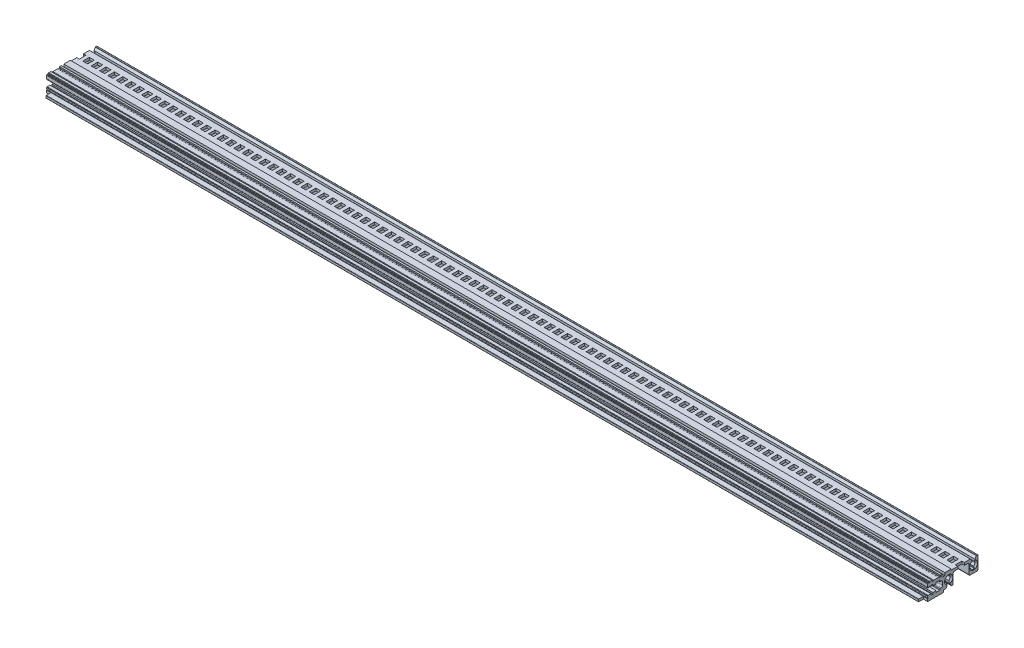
SolidWorks part; units mm, degrees
other "1"
ref_plane "前视基准面" through (0, 0, 0) normal (0, 0, 1) x (1, 0, 0)
ref_plane "上视基准面" through (0, 0, 0) normal (0, 1, 0) x (1, 0, 0)
ref_plane "右视基准面" through (0, 0, 0) normal (1, 0, 0) x (0, 0, -1)
imported_body "输入1"
sketch "草图1" plane through (215.9, 0, 0) normal (1, 0, 0) x (0, 0, -1)
  line L1 (-26.4209, 2.8831) -> (15.5559, 2.8831)
  line L2 (-26.4209, 2.8831) -> (-26.4209, -10.7534)
  line L3 (-26.4209, -10.7534) -> (15.5559, -10.7534)
  line L4 (15.5559, 2.8831) -> (15.5559, -10.7534)
extrude "切除-拉伸1" cut sketch "草图1" against normal up to surface (21.82 mm away)
sketch "草图2" plane through (194.08, 0, 0) normal (1, 0, 0) x (0, 0, -1)
  line L74 (5.5936, 0) -> (-5.95, 0)
  line L75 (-5.95, 0) -> (-5.95, 0.6)
  line L76 (-5.95, 0.6) -> (-9.85, 0.6)
  line L77 (-9.85, 0.6) -> (-9.85, -0.8)
  line L78 (-10.05, -1) -> (-11.25, -1)
  line L79 (-11.45, -0.8) -> (-11.45, 0.6)
  line L80 (-11.45, 0.6) -> (-12.5, 0.6)
  line L81 (-12.5, 0.6) -> (-12.5, -0.1)
  line L82 (-12.7, -0.3) -> (-13.3, -0.3)
  line L83 (-13.6873, 0) -> (-16.5127, 0)
  line L84 (-16.9, -0.3) -> (-17.5, -0.3)
  line L85 (-17.7, -0.1) -> (-17.7, 0.6)
  line L86 (-17.7, 0.6) -> (-18.95, 0.6)
  line L87 (-19.15, 0.4) -> (-19.15, 0.1)
  line L88 (-19.35, -0.1) -> (-19.45, -0.1)
  line L89 (-19.65, 0.1) -> (-19.65, 0.2)
  line L90 (-19.85, 0.4) -> (-19.95, 0.4)
  line L91 (-20.15, 0.2) -> (-20.15, 0.0328)
  line L92 (-20.2086, -0.1086) -> (-20.25, -0.15)
  line L93 (-20.25, -0.15) -> (-20.25, -1.95)
  line L94 (-20.25, -1.95) -> (-20.2086, -1.9914)
  line L95 (-20.15, -2.1328) -> (-20.15, -2.3)
  line L96 (-19.95, -2.5) -> (-19.85, -2.5)
  line L97 (-19.65, -2.3) -> (-19.65, -2.2)
  line L98 (-19.45, -2) -> (-19.2328, -2)
  line L99 (-19.0914, -2.0586) -> (-18.5089, -2.6411)
  line L100 (-18.3675, -2.6997) -> (-18.25, -2.6997)
  line L101 (-18.25, -2.6997) -> (-18.25, -1.85)
  line L102 (-18.25, -1.85) -> (-17.05, -1.85)
  line L103 (-17.05, -1.85) -> (-17.05, -2.7)
  line L104 (-17.05, -2.7) -> (-15.05, -2.7)
  line L105 (-15.05, -2.7) -> (-15.05, -1.85)
  line L106 (-15.05, -1.85) -> (-12.85, -1.85)
  line L107 (-12.85, -1.85) -> (-12.85, -2.7)
  line L108 (-12.85, -2.7) -> (-12.05, -2.7)
  line L109 (-11.25, -3.5) -> (-11.25, -5.45)
  line L110 (-12.05, -6.25) -> (-12.85, -6.25)
  line L111 (-12.85, -6.25) -> (-12.85, -7.1)
  line L112 (-12.85, -7.1) -> (-15.05, -7.1)
  line L113 (-15.05, -7.1) -> (-15.05, -6.25)
  line L114 (-15.05, -6.25) -> (-17.05, -6.25)
  line L115 (-17.05, -6.25) -> (-17.05, -7.1)
  line L116 (-17.05, -7.1) -> (-18.25, -7.1)
  line L117 (-18.25, -7.1) -> (-18.25, -6.2497)
  line L118 (-18.25, -6.2497) -> (-19.95, -6.2497)
  line L119 (-20.1974, -6.497) -> (-20.25, -6.5497)
  line L120 (-20.25, -6.5497) -> (-20.25, -7.2765)
  line L121 (-20.15, -7.4497) -> (-20.15, -7.8)
  line L122 (-20.25, -7.9) -> (-23.05, -7.9)
  line L123 (-23.25, -8.1) -> (-23.25, -9.2)
  line L124 (-23.05, -9.4) -> (-10.9, -9.4)
  line L125 (-10.7, -9.2) -> (-10.7, -8.1)
  line L126 (-10.7, -8.1) -> (-9.2333, -8.1)
  line L127 (-9.0601, -8) -> (-8.425, -6.9)
  line L128 (-8.425, -6.9) -> (-8.425, -5.0408)
  line L129 (-8.425, -3.3592) -> (-8.425, -2.557)
  line L130 (-8.075, -1.7) -> (-6.925, -1.7)
  line L131 (-6.575, -2.5571) -> (-6.575, -3.3592)
  line L132 (-6.575, -5.0408) -> (-6.575, -6.9001)
  line L133 (-6.575, -6.9001) -> (-5.7669, -8.3)
  line L134 (-5.5937, -8.4) -> (-4.95, -8.4)
  line L135 (-4.75, -8.2) -> (-4.75, -2.3)
  line L136 (-3.95, -1.5) -> (3.95, -1.5)
  line L137 (4.75, -2.3) -> (4.75, -7.6)
  line L138 (5.55, -8.4) -> (9.45, -8.4)
  line L139 (10.25, -7.6) -> (10.25, -0.2)
  line L140 (10.05, 0) -> (9.4065, 0)
  line L141 (9.2333, -0.1) -> (8.425, -1.5)
  line L142 (8.425, -1.5) -> (8.425, -3.3592)
  line L143 (8.425, -5.0408) -> (8.425, -6.2)
  line L144 (8.225, -6.4) -> (6.775, -6.4)
  line L145 (6.575, -6.2) -> (6.575, -5.0408)
  line L146 (6.575, -3.3592) -> (6.575, -1.5)
  line L147 (6.575, -1.5) -> (5.7668, -0.1)
  line L148 (5.5936, 0) -> (-5.95, 0)
  line L149 (-5.95, 0) -> (-5.95, 0.6)
  line L150 (-5.95, 0.6) -> (-9.85, 0.6)
  line L151 (-9.85, 0.6) -> (-9.85, -0.8)
  line L152 (-10.05, -1) -> (-11.25, -1)
  line L153 (-11.45, -0.8) -> (-11.45, 0.6)
  line L154 (-11.45, 0.6) -> (-12.5, 0.6)
  line L155 (-12.5, 0.6) -> (-12.5, -0.1)
  line L156 (-12.7, -0.3) -> (-13.3, -0.3)
  line L157 (-13.6873, 0) -> (-16.5127, 0)
  line L158 (-16.9, -0.3) -> (-17.5, -0.3)
  line L159 (-17.7, -0.1) -> (-17.7, 0.6)
  line L160 (-17.7, 0.6) -> (-18.95, 0.6)
  line L161 (-19.15, 0.4) -> (-19.15, 0.1)
  line L162 (-19.35, -0.1) -> (-19.45, -0.1)
  line L163 (-19.65, 0.1) -> (-19.65, 0.2)
  line L164 (-19.85, 0.4) -> (-19.95, 0.4)
  line L165 (-20.15, 0.2) -> (-20.15, 0.0328)
  line L166 (-20.2086, -0.1086) -> (-20.25, -0.15)
  line L167 (-20.25, -0.15) -> (-20.25, -1.95)
  line L168 (-20.25, -1.95) -> (-20.2086, -1.9914)
  line L169 (-20.15, -2.1328) -> (-20.15, -2.3)
  line L170 (-19.95, -2.5) -> (-19.85, -2.5)
  line L171 (-19.65, -2.3) -> (-19.65, -2.2)
  line L172 (-19.45, -2) -> (-19.2328, -2)
  line L173 (-19.0914, -2.0586) -> (-18.5089, -2.6411)
  line L174 (-18.3675, -2.6997) -> (-18.25, -2.6997)
  line L175 (-18.25, -2.6997) -> (-18.25, -1.85)
  line L176 (-18.25, -1.85) -> (-17.05, -1.85)
  line L177 (-17.05, -1.85) -> (-17.05, -2.7)
  line L178 (-17.05, -2.7) -> (-15.05, -2.7)
  line L179 (-15.05, -2.7) -> (-15.05, -1.85)
  line L180 (-15.05, -1.85) -> (-12.85, -1.85)
  line L181 (-12.85, -1.85) -> (-12.85, -2.7)
  line L182 (-12.85, -2.7) -> (-12.05, -2.7)
  line L183 (-11.25, -3.5) -> (-11.25, -5.45)
  line L184 (-12.05, -6.25) -> (-12.85, -6.25)
  line L185 (-12.85, -6.25) -> (-12.85, -7.1)
  line L186 (-12.85, -7.1) -> (-15.05, -7.1)
  line L187 (-15.05, -7.1) -> (-15.05, -6.25)
  line L188 (-15.05, -6.25) -> (-17.05, -6.25)
  line L189 (-17.05, -6.25) -> (-17.05, -7.1)
  line L190 (-17.05, -7.1) -> (-18.25, -7.1)
  line L191 (-18.25, -7.1) -> (-18.25, -6.2497)
  line L192 (-18.25, -6.2497) -> (-19.95, -6.2497)
  line L193 (-20.1974, -6.497) -> (-20.25, -6.5497)
  line L194 (-20.25, -6.5497) -> (-20.25, -7.2765)
  line L195 (-20.15, -7.4497) -> (-20.15, -7.8)
  line L196 (-20.25, -7.9) -> (-23.05, -7.9)
  line L197 (-23.25, -8.1) -> (-23.25, -9.2)
  line L198 (-23.05, -9.4) -> (-10.9, -9.4)
  line L199 (-10.7, -9.2) -> (-10.7, -8.1)
  line L200 (-10.7, -8.1) -> (-9.2333, -8.1)
  line L201 (-9.0601, -8) -> (-8.425, -6.9)
  line L202 (-8.425, -6.9) -> (-8.425, -5.0408)
  line L203 (-8.425, -3.3592) -> (-8.425, -2.557)
  line L204 (-8.075, -1.7) -> (-6.925, -1.7)
  line L205 (-6.575, -2.5571) -> (-6.575, -3.3592)
  line L206 (-6.575, -5.0408) -> (-6.575, -6.9001)
  line L207 (-6.575, -6.9001) -> (-5.7669, -8.3)
  line L208 (-5.5937, -8.4) -> (-4.95, -8.4)
  line L209 (-4.75, -8.2) -> (-4.75, -2.3)
  line L210 (-3.95, -1.5) -> (3.95, -1.5)
  line L211 (4.75, -2.3) -> (4.75, -7.6)
  line L212 (5.55, -8.4) -> (9.45, -8.4)
  line L213 (10.25, -7.6) -> (10.25, -0.2)
  line L214 (10.05, 0) -> (9.4065, 0)
  line L215 (9.2333, -0.1) -> (8.425, -1.5)
  line L216 (8.425, -1.5) -> (8.425, -3.3592)
  line L217 (8.425, -5.0408) -> (8.425, -6.2)
  line L218 (8.225, -6.4) -> (6.775, -6.4)
  line L219 (6.575, -6.2) -> (6.575, -5.0408)
  line L220 (6.575, -3.3592) -> (6.575, -1.5)
  line L221 (6.575, -1.5) -> (5.7668, -0.1)
  arc A47 (-10.05, -1) -> (-9.85, -0.8) centre (-10.05, -0.8) ccw
  arc A48 (-11.45, -0.8) -> (-11.25, -1) centre (-11.25, -0.8) ccw
  arc A49 (-12.7, -0.3) -> (-12.5, -0.1) centre (-12.7, -0.1) ccw
  arc A50 (-13.4936, -0.15) -> (-13.3, -0.3) centre (-13.3, -0.1) ccw
  arc A51 (-13.4936, -0.15) -> (-13.6873, 0) centre (-13.6873, -0.2) ccw
  arc A52 (-16.5127, 0) -> (-16.7063, -0.15) centre (-16.5127, -0.2) ccw
  arc A53 (-16.9, -0.3) -> (-16.7063, -0.15) centre (-16.9, -0.1) ccw
  arc A54 (-17.7, -0.1) -> (-17.5, -0.3) centre (-17.5, -0.1) ccw
  arc A55 (-18.95, 0.6) -> (-19.15, 0.4) centre (-18.95, 0.4) ccw
  arc A56 (-19.35, -0.1) -> (-19.15, 0.1) centre (-19.35, 0.1) ccw
  arc A57 (-19.65, 0.1) -> (-19.45, -0.1) centre (-19.45, 0.1) ccw
  arc A58 (-19.65, 0.2) -> (-19.85, 0.4) centre (-19.85, 0.2) ccw
  arc A59 (-19.95, 0.4) -> (-20.15, 0.2) centre (-19.95, 0.2) ccw
  arc A60 (-20.2086, -0.1086) -> (-20.15, 0.0328) centre (-20.35, 0.0328) ccw
  arc A61 (-20.15, -2.1328) -> (-20.2086, -1.9914) centre (-20.35, -2.1328) ccw
  arc A62 (-20.15, -2.3) -> (-19.95, -2.5) centre (-19.95, -2.3) ccw
  arc A63 (-19.85, -2.5) -> (-19.65, -2.3) centre (-19.85, -2.3) ccw
  arc A64 (-19.45, -2) -> (-19.65, -2.2) centre (-19.45, -2.2) ccw
  arc A65 (-19.0914, -2.0586) -> (-19.2328, -2) centre (-19.2328, -2.2) ccw
  arc A66 (-18.5089, -2.6411) -> (-18.3675, -2.6997) centre (-18.3675, -2.4997) ccw
  arc A67 (-11.25, -3.5) -> (-12.05, -2.7) centre (-12.05, -3.5) ccw
  arc A68 (-12.05, -6.25) -> (-11.25, -5.45) centre (-12.05, -5.45) ccw
  arc A69 (-19.95, -6.2497) -> (-20.1444, -6.4026) centre (-19.95, -6.4497) ccw
  arc A70 (-20.1974, -6.497) -> (-20.1444, -6.4026) centre (-20.3388, -6.3556) ccw
  arc A71 (-20.15, -7.4497) -> (-20.25, -7.2765) centre (-20.35, -7.4497) ccw
  arc A72 (-20.25, -7.9) -> (-20.15, -7.8) centre (-20.25, -7.8) ccw
  arc A73 (-23.05, -7.9) -> (-23.25, -8.1) centre (-23.05, -8.1) ccw
  arc A74 (-23.25, -9.2) -> (-23.05, -9.4) centre (-23.05, -9.2) ccw
  arc A75 (-10.9, -9.4) -> (-10.7, -9.2) centre (-10.9, -9.2) ccw
  arc A76 (-9.2333, -8.1) -> (-9.0601, -8) centre (-9.2333, -7.9) ccw
  arc A77 (-8.425, -3.3592) -> (-8.425, -5.0408) centre (-7.5, -4.2) ccw
  arc A78 (-8.075, -1.7) -> (-8.425, -2.557) centre (-8.075, -2.2) ccw
  arc A79 (-6.575, -2.5571) -> (-6.925, -1.7) centre (-6.925, -2.2) ccw
  arc A80 (-6.575, -5.0408) -> (-6.575, -3.3592) centre (-7.5, -4.2) ccw
  arc A81 (-5.7669, -8.3) -> (-5.5937, -8.4) centre (-5.5937, -8.2) ccw
  arc A82 (-4.95, -8.4) -> (-4.75, -8.2) centre (-4.95, -8.2) ccw
  arc A83 (-3.95, -1.5) -> (-4.75, -2.3) centre (-3.95, -2.3) ccw
  arc A84 (4.75, -2.3) -> (3.95, -1.5) centre (3.95, -2.3) ccw
  arc A85 (4.75, -7.6) -> (5.55, -8.4) centre (5.55, -7.6) ccw
  arc A86 (9.45, -8.4) -> (10.25, -7.6) centre (9.45, -7.6) ccw
  arc A87 (10.25, -0.2) -> (10.05, 0) centre (10.05, -0.2) ccw
  arc A88 (9.4065, 0) -> (9.2333, -0.1) centre (9.4065, -0.2) ccw
  arc A89 (8.425, -5.0408) -> (8.425, -3.3592) centre (7.5, -4.2) ccw
  arc A90 (8.225, -6.4) -> (8.425, -6.2) centre (8.225, -6.2) ccw
  arc A91 (6.575, -6.2) -> (6.775, -6.4) centre (6.775, -6.2) ccw
  arc A92 (6.575, -3.3592) -> (6.575, -5.0408) centre (7.5, -4.2) ccw
  arc A93 (5.7668, -0.1) -> (5.5936, 0) centre (5.5936, -0.2) ccw
  arc A94 (-10.05, -1) -> (-9.85, -0.8) centre (-10.05, -0.8) ccw
  arc A95 (-11.45, -0.8) -> (-11.25, -1) centre (-11.25, -0.8) ccw
  arc A96 (-12.7, -0.3) -> (-12.5, -0.1) centre (-12.7, -0.1) ccw
  arc A97 (-13.4936, -0.15) -> (-13.3, -0.3) centre (-13.3, -0.1) ccw
  arc A98 (-13.4936, -0.15) -> (-13.6873, 0) centre (-13.6873, -0.2) ccw
  arc A99 (-16.5127, 0) -> (-16.7063, -0.15) centre (-16.5127, -0.2) ccw
  arc A100 (-16.9, -0.3) -> (-16.7063, -0.15) centre (-16.9, -0.1) ccw
  arc A101 (-17.7, -0.1) -> (-17.5, -0.3) centre (-17.5, -0.1) ccw
  arc A102 (-18.95, 0.6) -> (-19.15, 0.4) centre (-18.95, 0.4) ccw
  arc A103 (-19.35, -0.1) -> (-19.15, 0.1) centre (-19.35, 0.1) ccw
  arc A104 (-19.65, 0.1) -> (-19.45, -0.1) centre (-19.45, 0.1) ccw
  arc A105 (-19.65, 0.2) -> (-19.85, 0.4) centre (-19.85, 0.2) ccw
  arc A106 (-19.95, 0.4) -> (-20.15, 0.2) centre (-19.95, 0.2) ccw
  arc A107 (-20.2086, -0.1086) -> (-20.15, 0.0328) centre (-20.35, 0.0328) ccw
  arc A108 (-20.15, -2.1328) -> (-20.2086, -1.9914) centre (-20.35, -2.1328) ccw
  arc A109 (-20.15, -2.3) -> (-19.95, -2.5) centre (-19.95, -2.3) ccw
  arc A110 (-19.85, -2.5) -> (-19.65, -2.3) centre (-19.85, -2.3) ccw
  arc A111 (-19.45, -2) -> (-19.65, -2.2) centre (-19.45, -2.2) ccw
  arc A112 (-19.0914, -2.0586) -> (-19.2328, -2) centre (-19.2328, -2.2) ccw
  arc A113 (-18.5089, -2.6411) -> (-18.3675, -2.6997) centre (-18.3675, -2.4997) ccw
  arc A114 (-11.25, -3.5) -> (-12.05, -2.7) centre (-12.05, -3.5) ccw
  arc A115 (-12.05, -6.25) -> (-11.25, -5.45) centre (-12.05, -5.45) ccw
  arc A116 (-19.95, -6.2497) -> (-20.1444, -6.4026) centre (-19.95, -6.4497) ccw
  arc A117 (-20.1974, -6.497) -> (-20.1444, -6.4026) centre (-20.3388, -6.3556) ccw
  arc A118 (-20.15, -7.4497) -> (-20.25, -7.2765) centre (-20.35, -7.4497) ccw
  arc A119 (-20.25, -7.9) -> (-20.15, -7.8) centre (-20.25, -7.8) ccw
  arc A120 (-23.05, -7.9) -> (-23.25, -8.1) centre (-23.05, -8.1) ccw
  arc A121 (-23.25, -9.2) -> (-23.05, -9.4) centre (-23.05, -9.2) ccw
  arc A122 (-10.9, -9.4) -> (-10.7, -9.2) centre (-10.9, -9.2) ccw
  arc A123 (-9.2333, -8.1) -> (-9.0601, -8) centre (-9.2333, -7.9) ccw
  arc A124 (-8.425, -3.3592) -> (-8.425, -5.0408) centre (-7.5, -4.2) ccw
  arc A125 (-8.075, -1.7) -> (-8.425, -2.557) centre (-8.075, -2.2) ccw
  arc A126 (-6.575, -2.5571) -> (-6.925, -1.7) centre (-6.925, -2.2) ccw
  arc A127 (-6.575, -5.0408) -> (-6.575, -3.3592) centre (-7.5, -4.2) ccw
  arc A128 (-5.7669, -8.3) -> (-5.5937, -8.4) centre (-5.5937, -8.2) ccw
  arc A129 (-4.95, -8.4) -> (-4.75, -8.2) centre (-4.95, -8.2) ccw
  arc A130 (-3.95, -1.5) -> (-4.75, -2.3) centre (-3.95, -2.3) ccw
  arc A131 (4.75, -2.3) -> (3.95, -1.5) centre (3.95, -2.3) ccw
  arc A132 (4.75, -7.6) -> (5.55, -8.4) centre (5.55, -7.6) ccw
  arc A133 (9.45, -8.4) -> (10.25, -7.6) centre (9.45, -7.6) ccw
  arc A134 (10.25, -0.2) -> (10.05, 0) centre (10.05, -0.2) ccw
  arc A135 (9.4065, 0) -> (9.2333, -0.1) centre (9.4065, -0.2) ccw
  arc A136 (8.425, -5.0408) -> (8.425, -3.3592) centre (7.5, -4.2) ccw
  arc A137 (8.225, -6.4) -> (8.425, -6.2) centre (8.225, -6.2) ccw
  arc A138 (6.575, -6.2) -> (6.775, -6.4) centre (6.775, -6.2) ccw
  arc A139 (6.575, -3.3592) -> (6.575, -5.0408) centre (7.5, -4.2) ccw
  arc A140 (5.7668, -0.1) -> (5.5936, 0) centre (5.5936, -0.2) ccw
  dimension "D1" = 0
extrude "凸台-拉伸1" add sketch "草图2" along normal blind 123.42
sketch "草图3" plane through (317.5, 0, 0) normal (1, 0, 0) x (0, 0, -1)
  circle A0 centre (-7.5, -4.2) radius 1.65
  circle A1 centre (7.5, -4.2) radius 1.65
extrude "切除-拉伸2" cut sketch "草图3" against normal blind 15.02
chamfer "倒角1" distance 0.85 angle 45 3 edges at (317.5, -4.2, -5.85) (317.5, -4.2, 5.85) (317.5, -4.2, 9.15)
sketch "草图4" plane through (0, 0, 0) normal (0, 1, 0) x (1, 0, 0)
  line L0 (192, 2) -> (192, -2) construction
  line L1 (194.08, 2) -> (197.08, 2)
  line L2 (194.08, 2) -> (194.08, -2)
  line L3 (194.08, -2) -> (197.08, -2)
  line L4 (197.08, 2) -> (197.08, -2)
  line L5 (189, 2) -> (192, 2) construction
  line L6 (192, -2) -> (189, -2) construction
  line L7 (199.16, -2) -> (202.16, -2)
  line L8 (199.16, 2) -> (199.16, -2)
  line L9 (199.16, 2) -> (202.16, 2)
  line L10 (202.16, 2) -> (202.16, -2)
  line L11 (204.24, -2) -> (207.24, -2)
  line L12 (204.24, 2) -> (204.24, -2)
  line L13 (204.24, 2) -> (207.24, 2)
  line L14 (207.24, 2) -> (207.24, -2)
  line L15 (209.32, -2) -> (212.32, -2)
  line L16 (209.32, 2) -> (209.32, -2)
  line L17 (209.32, 2) -> (212.32, 2)
  line L18 (212.32, 2) -> (212.32, -2)
  line L19 (214.4, -2) -> (217.4, -2)
  line L20 (214.4, 2) -> (214.4, -2)
  line L21 (214.4, 2) -> (217.4, 2)
  line L22 (217.4, 2) -> (217.4, -2)
  line L23 (219.48, -2) -> (222.48, -2)
  line L24 (219.48, 2) -> (219.48, -2)
  line L25 (219.48, 2) -> (222.48, 2)
  line L26 (222.48, 2) -> (222.48, -2)
  line L27 (224.56, -2) -> (227.56, -2)
  line L28 (224.56, 2) -> (224.56, -2)
  line L29 (224.56, 2) -> (227.56, 2)
  line L30 (227.56, 2) -> (227.56, -2)
  line L31 (229.64, -2) -> (232.64, -2)
  line L32 (229.64, 2) -> (229.64, -2)
  line L33 (229.64, 2) -> (232.64, 2)
  line L34 (232.64, 2) -> (232.64, -2)
  line L35 (234.72, -2) -> (237.72, -2)
  line L36 (234.72, 2) -> (234.72, -2)
  line L37 (234.72, 2) -> (237.72, 2)
  line L38 (237.72, 2) -> (237.72, -2)
  line L39 (239.8, -2) -> (242.8, -2)
  line L40 (239.8, 2) -> (239.8, -2)
  line L41 (239.8, 2) -> (242.8, 2)
  line L42 (242.8, 2) -> (242.8, -2)
  line L43 (244.88, -2) -> (247.88, -2)
  line L44 (244.88, 2) -> (244.88, -2)
  line L45 (244.88, 2) -> (247.88, 2)
  line L46 (247.88, 2) -> (247.88, -2)
  line L47 (249.96, -2) -> (252.96, -2)
  line L48 (249.96, 2) -> (249.96, -2)
  line L49 (249.96, 2) -> (252.96, 2)
  line L50 (252.96, 2) -> (252.96, -2)
  line L51 (255.04, -2) -> (258.04, -2)
  line L52 (255.04, 2) -> (255.04, -2)
  line L53 (255.04, 2) -> (258.04, 2)
  line L54 (258.04, 2) -> (258.04, -2)
  line L55 (260.12, -2) -> (263.12, -2)
  line L56 (260.12, 2) -> (260.12, -2)
  line L57 (260.12, 2) -> (263.12, 2)
  line L58 (263.12, 2) -> (263.12, -2)
  line L59 (265.2, -2) -> (268.2, -2)
  line L60 (265.2, 2) -> (265.2, -2)
  line L61 (265.2, 2) -> (268.2, 2)
  line L62 (268.2, 2) -> (268.2, -2)
  line L63 (270.28, -2) -> (273.28, -2)
  line L64 (270.28, 2) -> (270.28, -2)
  line L65 (270.28, 2) -> (273.28, 2)
  line L66 (273.28, 2) -> (273.28, -2)
  line L67 (275.36, -2) -> (278.36, -2)
  line L68 (275.36, 2) -> (275.36, -2)
  line L69 (275.36, 2) -> (278.36, 2)
  line L70 (278.36, 2) -> (278.36, -2)
  line L71 (280.44, -2) -> (283.44, -2)
  line L72 (280.44, 2) -> (280.44, -2)
  line L73 (280.44, 2) -> (283.44, 2)
  line L74 (283.44, 2) -> (283.44, -2)
  line L75 (285.52, -2) -> (288.52, -2)
  line L76 (285.52, 2) -> (285.52, -2)
  line L77 (285.52, 2) -> (288.52, 2)
  line L78 (288.52, 2) -> (288.52, -2)
  line L79 (290.6, -2) -> (293.6, -2)
  line L80 (290.6, 2) -> (290.6, -2)
  line L81 (290.6, 2) -> (293.6, 2)
  line L82 (293.6, 2) -> (293.6, -2)
  line L83 (295.68, -2) -> (298.68, -2)
  line L84 (295.68, 2) -> (295.68, -2)
  line L85 (295.68, 2) -> (298.68, 2)
  line L86 (298.68, 2) -> (298.68, -2)
  line L87 (300.76, -2) -> (303.76, -2)
  line L88 (300.76, 2) -> (300.76, -2)
  line L89 (300.76, 2) -> (303.76, 2)
  line L90 (303.76, 2) -> (303.76, -2)
  line L91 (305.84, -2) -> (308.84, -2)
  line L92 (305.84, 2) -> (305.84, -2)
  line L93 (305.84, 2) -> (308.84, 2)
  line L94 (308.84, 2) -> (308.84, -2)
  line L95 (310.92, -2) -> (313.92, -2)
  line L96 (310.92, 2) -> (310.92, -2)
  line L97 (310.92, 2) -> (313.92, 2)
  line L98 (313.92, 2) -> (313.92, -2)
  line L99 (316, -2) -> (319, -2)
  line L100 (316, 2) -> (316, -2)
  line L101 (316, 2) -> (319, 2)
  line L102 (319, 2) -> (319, -2)
  dimension "D1" = 3
  dimension "D2" = 5.08
  dimension "D3" = 25
extrude "切除-拉伸3" cut sketch "草图4" against normal through all
sketch "草图5" plane through (0, -7.9, 0) normal (0, 1, 0) x (1, 0, 0)
  line L1 (317.5, -23.25) -> (314.9, -23.25)
  line L2 (317.5, -23.25) -> (317.5, -20.25)
  line L3 (317.5, -20.25) -> (314.9, -20.25)
  line L4 (314.9, -23.25) -> (314.9, -20.25)
  dimension "D1" = 3
  dimension "D2" = 2.6
extrude "切除-拉伸4" cut sketch "草图5" against normal mid plane 4.02
